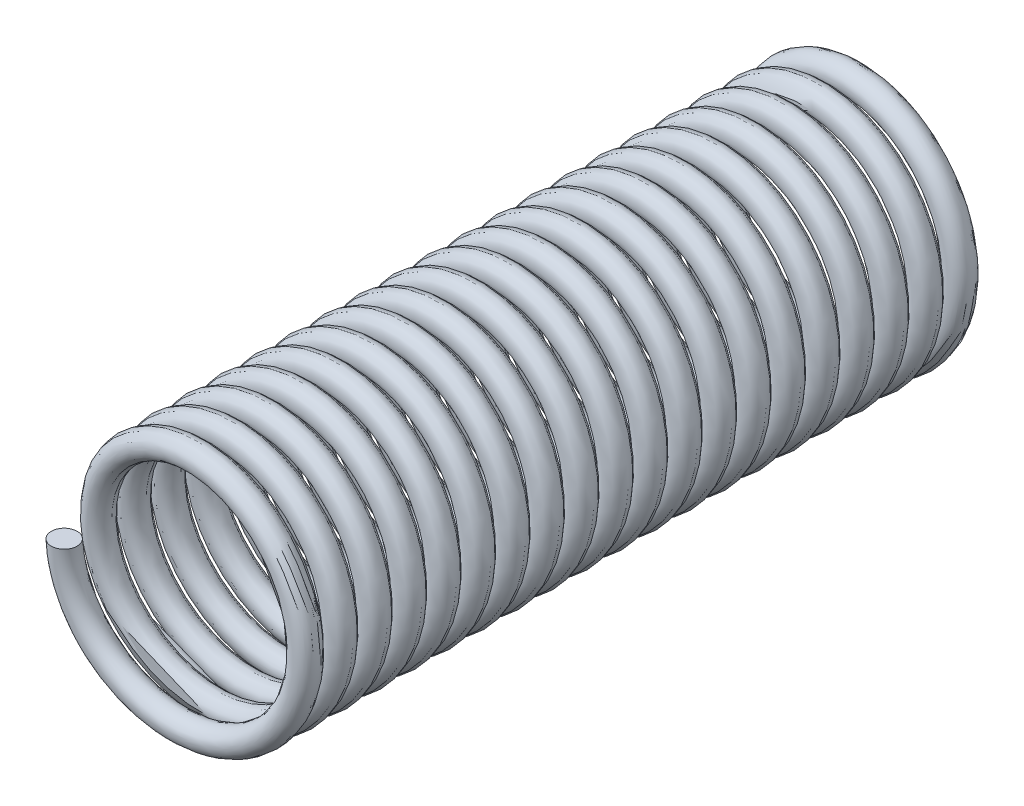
SolidWorks part; units mm, degrees
ref_plane "前视基准面" through (0, 0, 0) normal (0, 0, 1) x (1, 0, 0)
ref_plane "上视基准面" through (0, 0, 0) normal (0, 1, 0) x (1, 0, 0)
ref_plane "右视基准面" through (0, 0, 0) normal (1, 0, 0) x (0, 0, -1)
sketch "草图2" plane through (0, 0, 0) normal (0, 0, 1) x (1, 0, 0)
  circle A0 centre (0, 0) radius 6.5
  dimension "D1" = 13
curve "螺旋线/涡状线1"
sketch "草图3" plane through (0, 0, 0) normal (0, 1, 0) x (1, 0, 0)
  circle A0 centre (-6.5, 0) radius 0.75
  spline S0 degree 3 number of poles 323 (-6.5, 0) -> (-6.5, -40) construction
  dimension "D1" = 1.5
sweep "扫描1" add profiles "草图3" path "螺旋线/涡状线1"
